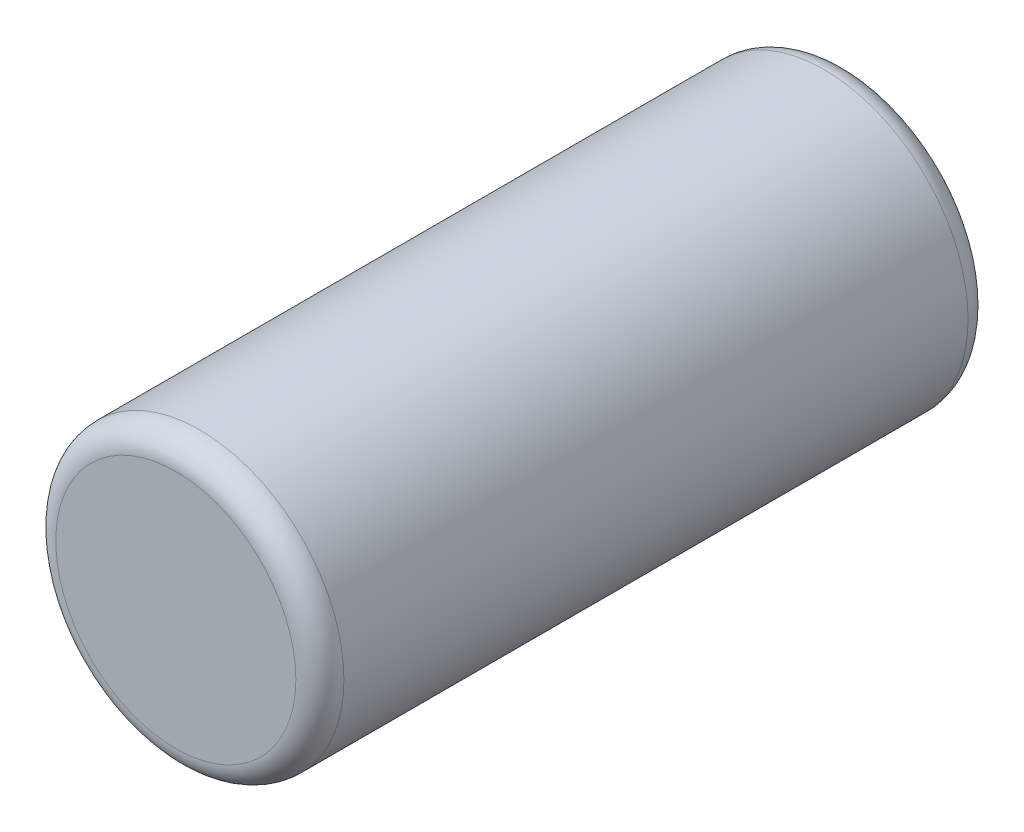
SolidWorks part; units mm, degrees
ref_plane "Спереди" through (0, 0, 0) normal (0, 0, 1) x (1, 0, 0)
ref_plane "Сверху" through (0, 0, 0) normal (0, 1, 0) x (1, 0, 0)
ref_plane "Справа" through (0, 0, 0) normal (1, 0, 0) x (0, 0, -1)
sketch "Эскиз1" plane through (0, 0, 0) normal (0, 0, 1) x (1, 0, 0)
  circle A0 centre (0, 0) radius 3
  dimension "D1" = 6
extrude "Бобышка-Вытянуть1" add sketch "Эскиз1" along normal mid plane 14
fillet "Скругление1" radius 0.5 2 edges at (3, 0, -7) (3, 0, 7)
